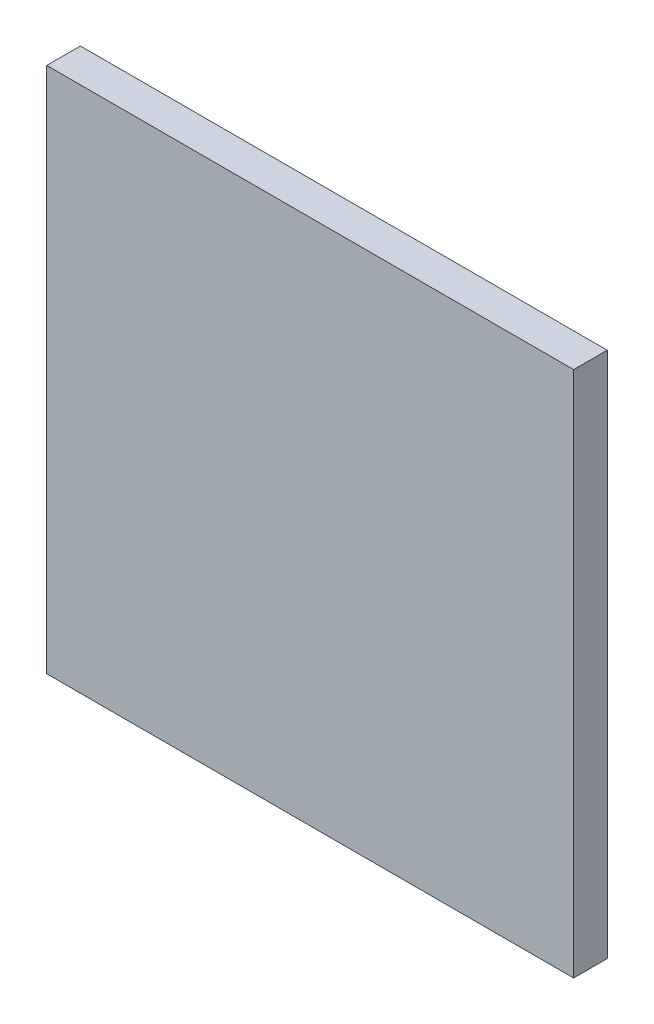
SolidWorks part; units mm, degrees
ref_plane "Plan de face" through (0, 0, 0) normal (0, 0, 1) x (1, 0, 0)
ref_plane "Plan de dessus" through (0, 0, 0) normal (0, 1, 0) x (1, 0, 0)
ref_plane "Plan de droite" through (0, 0, 0) normal (1, 0, 0) x (0, 0, -1)
sketch "Esquisse1" plane through (0, 0, 0) normal (0, 0, 1) x (1, 0, 0)
  line L1 (-23.5, 23.5) -> (23.5, 23.5)
  line L2 (-23.5, 23.5) -> (-23.5, -23.5)
  line L3 (-23.5, -23.5) -> (23.5, -23.5)
  line L4 (23.5, 23.5) -> (23.5, -23.5)
  line L5 (-23.5, 23.5) -> (23.5, -23.5) construction
  line L6 (-23.5, -23.5) -> (23.5, 23.5) construction
  point P0 (0, 0)
  dimension "D1" = 47
  dimension "D2" = 47
extrude "Boss.-Extru.1" add sketch "Esquisse1" along normal blind 3
